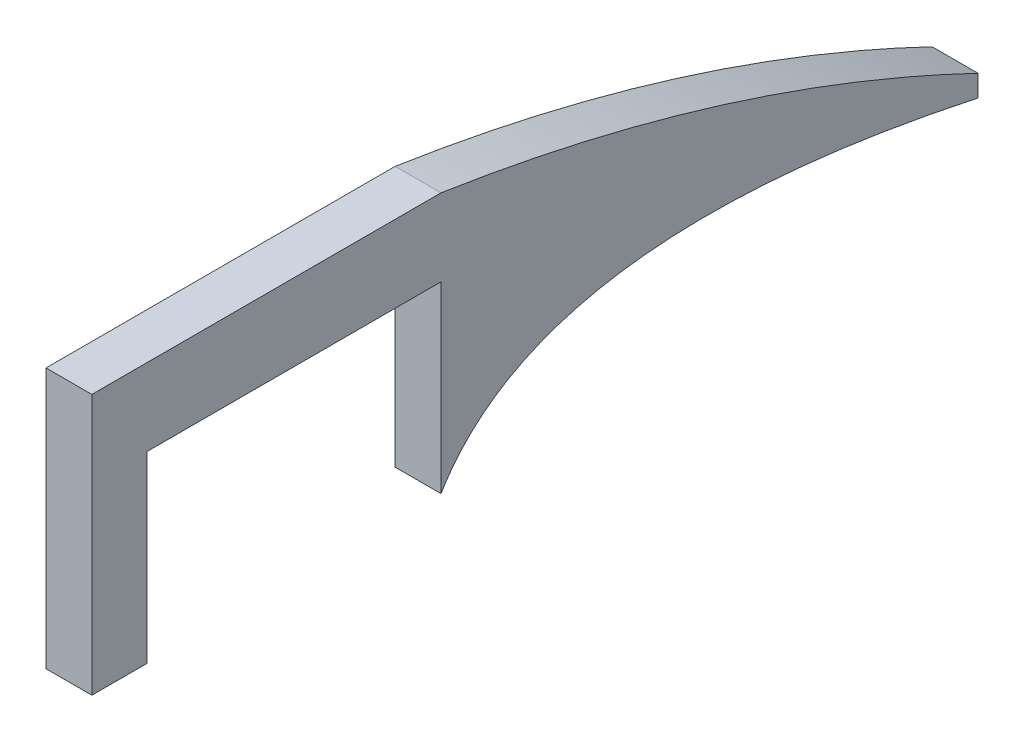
SolidWorks part; units mm, degrees
ref_plane "Front Plane" through (0, 0, 0) normal (0, 0, 1) x (1, 0, 0)
ref_plane "Top Plane" through (0, 0, 0) normal (0, 1, 0) x (1, 0, 0)
ref_plane "Right Plane" through (0, 0, 0) normal (1, 0, 0) x (0, 0, -1)
sketch "Sketch1" plane through (0, 0, 0) normal (1, 0, 0) x (0, 0, -1)
  line L0 (-61.341, -18.034) -> (-53.721, -18.034)
  line L1 (-13.0042, 18.034) -> (-61.341, 18.034)
  line L2 (61.341, -4.7981) -> (61.341, -7.7677)
  line L4 (-61.341, 18.034) -> (-61.341, -18.034)
  line L5 (28.3567, 8.3367) -> (-61.341, -18.034) construction
  line L6 (20.8491, -6.1296) -> (-61.341, 18.034) construction
  line L7 (-53.721, -18.034) -> (-53.721, 7.366)
  line L8 (-53.721, 7.366) -> (-13.0042, 7.366)
  line L9 (-13.0042, 7.366) -> (-13.0042, -18.034)
  line L10 (-53.721, -18.034) -> (-61.341, -18.034)
  spline S0 degree 2 poles (61.341, -7.7677) (0.8634, 5.2755) (-13.0042, -18.034) knots 0 0 0 0.897121 0.897121 0.897121
  spline S1 degree 2 poles (-13.0042, 18.034) (26.3392, 12.0038) (61.341, -4.7981) knots 0 0 0 0.877774 0.877774 0.877774
  point P0 (0, 0)
  point P3 (61.341, -4.7981)
  point P6 (61.341, -7.7677)
  dimension "D1" = 7.62
  dimension "D2" = 25.4
  dimension "D3" = 36.068
extrude "Boss-Extrude1" add sketch "Sketch1" along normal blind 6.35 contours S1 L1 L4 L0 L7 L8 L9 S0 L2
